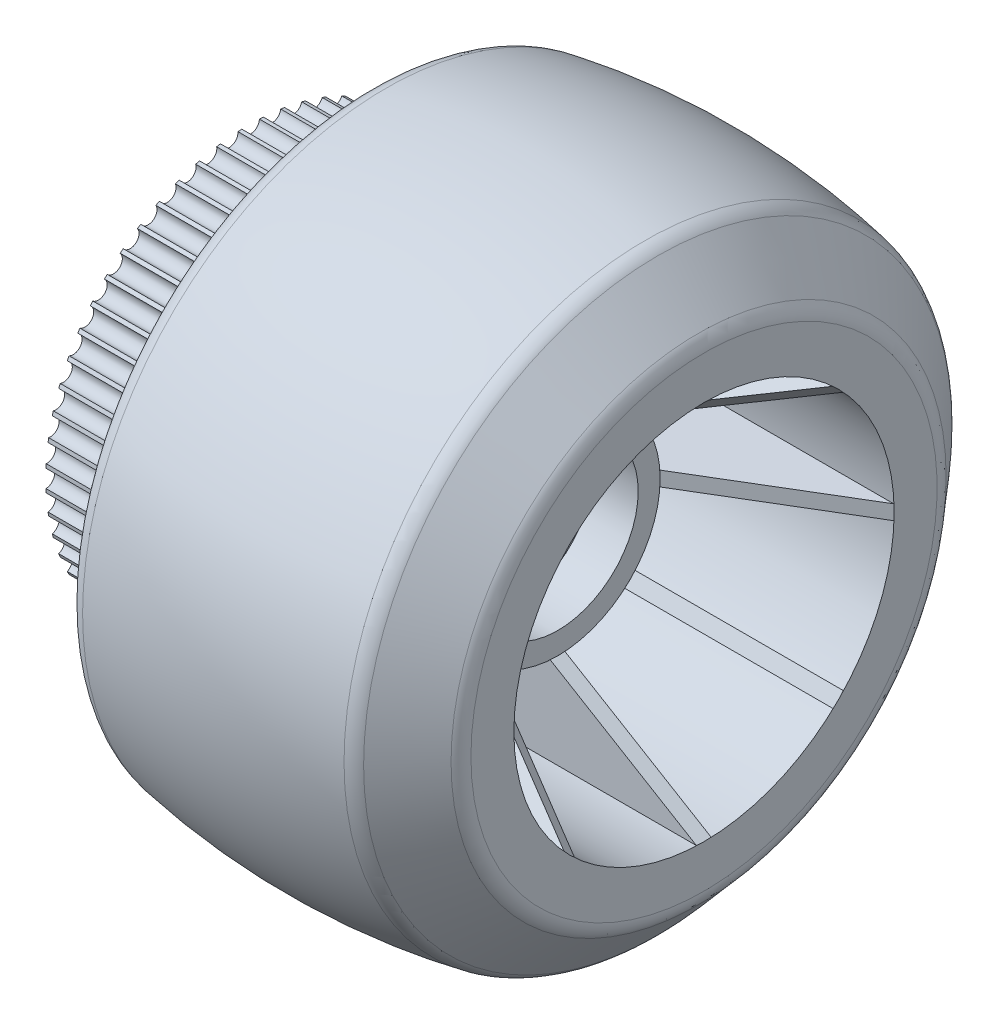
SolidWorks part; units mm, degrees
ref_plane "Face" through (0, 0, 0) normal (0, 0, 1) x (1, 0, 0)
ref_plane "Dessus" through (0, 0, 0) normal (0, 1, 0) x (1, 0, 0)
ref_plane "Droite" through (0, 0, 0) normal (1, 0, 0) x (0, 0, -1)
sketch "Esquisse1" plane through (0, 0, 0) normal (0, 0, 1) x (1, 0, 0)
  line L0 (-23, 0) -> (23, 0)
  line L1 (-51.3901, 43) -> (57.2773, 43) construction
  line L3 (23, 33) -> (23, 0)
  line L4 (-23, 41) -> (-23, 0)
  line L5 (-129.3418, 0) -> (132.6713, 0) construction
  line L6 (16, 41) -> (23, 33)
  arc A1 (16, 41) -> (-23, 41) centre (-3.5, -57.0803) ccw
  dimension "D5" = 39
  dimension "D8" = 100
  dimension "D1" = 46
  dimension "D2" = 23
  dimension "D3" = 43
  dimension "D4" = 33
  dimension "D6" = 41
  dimension "D7" = 41
revolve "Révolution2" add sketch "Esquisse1" angle 360 about L5
ref_plane "Plan1" through (-6.5, 0, 0) normal (1, 0, 0) x (0, 0, -1)
fillet "Congé1" radius 3 3 edges at (-23, 0, 41) (23, 0, 33) (16, 0, 41)
sketch "Esquisse2" plane through (-23, 0, 0) normal (-1, 0, 0) x (0, 0, 1)
  circle A0 centre (0, 0) radius 28
  dimension "D1" = 56
extrude "Enlèv. mat.-Extru.1" cut sketch "Esquisse2" against normal blind 1.5
sketch "Esquisse3" plane through (23, 0, 0) normal (1, 0, 0) x (0, 0, -1)
  circle A0 centre (0, 0) radius 26
  dimension "D1" = 52
extrude "Enlèv. mat.-Extru.2" cut sketch "Esquisse3" against normal blind 40
sketch "Esquisse4" plane through (-17, 0, 0) normal (1, 0, 0) x (0, 0, -1)
  circle A0 centre (0, 0) radius 14
  dimension "D1" = 28
extrude "Extrusion1" add sketch "Esquisse4" along normal blind 20
sketch "Esquisse5" plane through (0, 0, 0) normal (0, 1, 0) x (1, 0, 0)
  line L0 (3, 14) -> (23, 26)
  line L1 (3, -14) -> (3, 14) construction
rib "Nervure1" sketch "Esquisse5" sketch "Esquisse5" thickness 2 extrusion direction parallel to sketch draft on no parameters "D1"=2
ref_axis "Axe1" through (3, 0, 0) along (-1, 0, 0)
pattern_circular "Répétition circulaire1" count 8 over 360 about axis through (0, 0, 0) along (1, 0, 0) of "Nervure1"
sketch "Esquisse6" plane through (3, 0, 0) normal (1, 0, 0) x (0, 0, -1)
  circle A0 centre (0, 0) radius 11
  dimension "D1" = 22
extrude "Enlèv. mat.-Extru.3" cut sketch "Esquisse6" against normal blind 6
sketch "Esquisse7" plane through (-21.5, 0, 0) normal (-1, 0, 0) x (0, 0, 1)
  circle A0 centre (0, 0) radius 11
  dimension "D1" = 22
extrude "Enlèv. mat.-Extru.4" cut sketch "Esquisse7" against normal blind 6
sketch "Esquisse8" plane through (-15.5, 0, 0) normal (-1, 0, 0) x (0, 0, 1)
  circle A0 centre (0, 0) radius 9.25
  dimension "D1" = 18.5
extrude "Enlèv. mat.-Extru.5" cut sketch "Esquisse8" against normal through all
sketch "Esquisse9" plane through (-21.5, 0, 0) normal (-1, 0, 0) x (0, 0, 1)
  circle A0 centre (0, 0) radius 28 construction
  circle A1 centre (0, 0) radius 28
extrude "Extrusion2" add sketch "Esquisse9" along normal blind 17.5
sketch "Esquisse10" plane through (-39, 0, 0) normal (-1, 0, 0) x (0, 0, 1)
  line L0 (0, -4.4942) -> (0, 31.3607) construction
  line L1 (-1.2, 29.25) -> (1.2, 29.25)
  line L2 (1.2, 29.25) -> (1.2, 28)
  line L3 (-1.2, 29.25) -> (-1.2, 28)
  arc A0 (-1.2, 28) -> (1.2, 28) centre (0, 28) ccw
  dimension "D2" = 1.25
  dimension "D1" = 1.2
  dimension "D3" = 28
extrude "Enlèv. mat.-Extru.6" cut sketch "Esquisse10" against normal blind 15
pattern_circular "Répétition circulaire2" count 60 over 360 about axis through (0, 0, 0) along (1, 0, 0) of "Enlèv. mat.-Extru.6"
sketch "Esquisse11" plane through (-39, 0, 0) normal (-1, 0, 0) x (0, 0, 1)
  circle A0 centre (0, 0) radius 23.25
  dimension "D1" = 46.5
extrude "Enlèv. mat.-Extru.7" cut sketch "Esquisse11" against normal blind 17.5
sketch "Esquisse12" plane through (-21.5, 0, 0) normal (-1, 0, 0) x (0, 0, 1)
  circle A0 centre (0, 0) radius 17
  dimension "D1" = 34
extrude "Extru.-Mince1" add sketch "Esquisse12" along normal blind 13.5 thin
sketch "Esquisse14" plane through (-35, 0, 0) normal (-1, 0, 0) x (0, 0, 1)
  line L0 (0, 19.5) -> (0, 23.25)
  circle A0 centre (0, 0) radius 19.5 construction
  circle A1 centre (0, 0) radius 19.5 construction
  circle A2 centre (0, 0) radius 23.25 construction
rib "Nervure2" sketch "Esquisse14" sketch "Esquisse14" thickness 2.5 extrusion direction normal to sketch draft on no parameters "D1"=2.5
pattern_circular "Répétition circulaire3" count 8 over 360 about axis through (3, 0, 0) along (-1, 0, 0) of "Nervure2"
sketch "Esquisse15" plane through (-35, 0, 0) normal (-1, 0, 0) x (0, 0, 1)
  circle A0 centre (7.4623, 18.0157) radius 2.75
  arc A1 (12.8763, 14.6441) -> (1.25, 19.4599) centre (0, 0) ccw construction
  dimension "D1" = 5.5
extrude "Extrusion3" add sketch "Esquisse15" against normal up to surface (13.5 mm away)
sketch "Esquisse16" plane through (-35, 0, 0) normal (-1, 0, 0) x (0, 0, 1)
  circle A0 centre (7.4623, 18.0157) radius 1
  dimension "D1" = 2
extrude "Enlèv. mat.-Extru.8" cut sketch "Esquisse16" against normal up to surface (13.5 mm away)
pattern_circular "Répétition circulaire4" count 4 over 360 about axis through (0, 0, 0) along (1, 0, 0) of "Enlèv. mat.-Extru.8", "Extrusion3"
